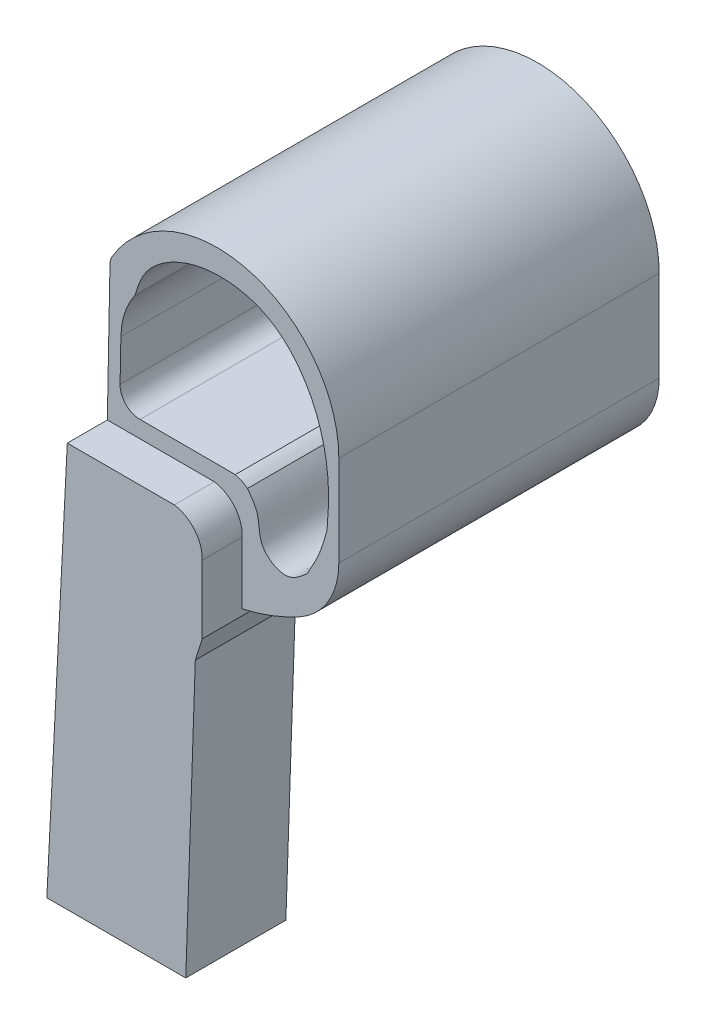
SolidWorks part; units mm, degrees
ref_plane "Ebene vorne" through (0, 0, 0) normal (0, 0, 1) x (1, 0, 0)
ref_plane "Ebene oben" through (0, 0, 0) normal (0, 1, 0) x (1, 0, 0)
ref_plane "Ebene rechts" through (0, 0, 0) normal (1, 0, 0) x (0, 0, -1)
sketch "Skizze3" plane through (0, 0, 0) normal (0, 0, 1) x (1, 0, 0)
  line L0 (-12.748, -52.9148) -> (-14.6943, -50.4877)
  line L1 (-14.6943, -50.4877) -> (-17.929, -50.4877)
  line L2 (-19.5552, -48.8102) -> (-17.5102, 17.0395)
  line L3 (-17.5102, 17.0395) -> (-16.3186, 17.0395)
  line L4 (-14.5075, 19.2478) -> (-13.9759, 46.7281)
  line L5 (-8.7711, 53.4222) -> (12.5993, 53.4222)
  line L6 (19.5494, 44.9018) -> (19.5494, 27.9209)
  line L7 (19.5494, 27.9209) -> (17.8303, 22.4647)
  line L8 (17.8303, 22.4647) -> (15.3711, -49.8358)
  line L9 (15.3711, -49.8358) -> (12.0099, -53.4594)
  line L10 (12.0099, -53.4594) -> (-12.748, -52.9148)
  circle A0 centre (0.1472, -2.0361) radius 3.5144
  arc A1 (-19.5552, -48.8102) -> (-17.929, -50.4877) centre (-17.929, -48.8607) ccw
  arc A2 (-16.3186, 17.0395) -> (-14.5075, 19.2478) centre (-16.8776, 19.3447) ccw
  arc A3 (-8.7711, 53.4222) -> (-13.9759, 46.7281) centre (-7.2405, 46.8617) ccw
  arc A4 (19.5494, 44.9018) -> (12.5993, 53.4222) centre (11.3313, 45.2932) ccw
sketch "Skizze4" plane through (0, 0, 0) normal (0, 0, 1) x (1, 0, 0)
  line L0 (-12.1967, 51.4246) -> (-13.1539, 51.4246)
  line L2 (-13.4766, 87.4439) -> (-14.1538, 52.4439)
  line L3 (19.5494, 44.9018) -> (19.5494, 27.9209) construction
  line L4 (43.6726, 51.3768) -> (43.6726, 74.0471)
  line L5 (-8.7711, 53.4222) -> (12.5993, 53.4222) construction
  line L8 (-8.7711, 53.4222) -> (12.5993, 53.4222)
  line L9 (19.5494, 44.9018) -> (19.5494, 29.4097)
  line L14 (-14.5075, 19.2478) -> (-13.9759, 46.7281) construction
  arc A0 (43.6726, 51.3768) -> (34.0095, 34.9386) centre (24.8592, 51.3768) cw
  arc A1 (43.6726, 74.0471) -> (-12.9301, 89.3862) centre (13.2929, 74.0471) ccw
  arc A2 (-12.9301, 89.3862) -> (-13.4766, 87.4439) centre (-9.4774, 87.3665) ccw
  arc A3 (-8.7711, 53.4222) -> (-13.9759, 46.7281) centre (-7.2405, 46.8617) ccw construction
  arc A4 (19.5494, 44.9018) -> (12.5993, 53.4222) centre (11.3313, 45.2932) ccw construction
  arc A5 (-8.7711, 53.4222) -> (-12.1967, 51.4246) centre (-7.2405, 46.8617) ccw
  arc A6 (19.5494, 44.9018) -> (12.5993, 53.4222) centre (11.3313, 45.2932) ccw
  arc A7 (34.0095, 34.9386) -> (19.5494, 29.4097) centre (7.5426, 82.4858) cw
  arc A8 (-14.1538, 52.4439) -> (-13.1539, 51.4246) centre (-13.1539, 52.4246) ccw
  point P13 (19.5494, 29.4097)
  point P14 (34.0095, 34.9386)
  dimension "D3" = 4
  dimension "D1" = 1
  dimension "D2" = 35
extrude "Linear austragen2" add sketch "Skizze4" against normal blind 65
sketch "Skizze8" plane through (0, 0, 0) normal (0, 0, 1) x (1, 0, 0)
  line L4 (-10.7531, 73.1244) -> (-10.9544, 62.7185)
  line L5 (-13.4766, 87.4439) -> (-14.1538, 52.4439) construction
  line L6 (-5.9641, 57.6218) -> (17.8078, 57.5801)
  arc A2 (-10.9544, 62.7185) -> (-5.9641, 57.6218) centre (-5.9554, 62.6218) ccw
  arc A3 (-10.7531, 73.1244) -> (-7.2516, 83.8309) centre (8.5054, 72.7518) cw
  arc A4 (43.6726, 74.0471) -> (-12.9301, 89.3862) centre (13.2929, 74.0471) ccw construction
  spline S0 degree 3 poles (-7.2516, 83.8309) (-6.6435, 85.7397) (-4.8338, 91.4199) (3.4739, 97.2386) (14.6974, 99.2738) (26.3685, 96.7743) (34.7702, 88.3663) (39.8457, 77.5371) (41.4737, 66.841) (40.9265, 59.6668) (40.7202, 56.961) knots 0.004715 0.004715 0.004715 0.004715 0.075335 0.214866 0.335973 0.47969 0.620641 0.743145 0.903126 1 1 1 1
  spline S1 degree 3 poles (17.8078, 57.5801) (18.2229, 57.4656) (19.3265, 57.1613) (20.2855, 56.5276) (20.8837, 56.1323) knots 0 0 0 0 0.37617 1 1 1 1
  spline S2 degree 3 poles (20.8837, 56.1323) (21.873, 54.7662) (24.1309, 51.6486) (23.2771, 45.0712) (30.5484, 40.5491) (34.0974, 43.6633) (35.7706, 45.1315) knots 0 0 0 0 0.203298 0.463965 0.74728 1 1 1 1
  spline S3 degree 3 poles (40.7202, 56.961) (40.1667, 54.9844) (39.0058, 50.8388) (36.8819, 47.0919) (35.7706, 45.1315) knots 0 0 0 0 0.476815 1 1 1 1
  point P11 (-11.5897, 91.4766)
  point P12 (-4.3987, 98.744)
  point P16 (12.0638, 104.402)
  point P17 (29.1231, 99.9765)
  point P18 (42.0464, 83.8535)
  point P19 (43.5921, 71.8367)
  point P20 (41.8776, 63.7593)
  point P21 (39.6822, 58.9961)
  point P22 (-5.0364, 89.3327)
  point P23 (4.1359, 96.6261)
  point P24 (14.1255, 98.5401)
  point P25 (25.8583, 95.7059)
  point P26 (34.4987, 87.614)
  point P27 (38.9877, 78.3563)
  point P28 (41.1046, 65.088)
  point P29 (40.7202, 56.961)
  point P35 (38.8407, 51.1216)
  point P39 (35.7706, 45.1315)
  point P41 (30.4524, 42.0953)
  point P43 (24.5857, 45.661)
  point P45 (23.3164, 51.8486)
  point P46 (20.8837, 56.1323)
  point P47 (19.0327, 57.19)
  dimension "D3" = 5
  dimension "D1" = 3
extrude "Schnitt-Linear austragen2" cut sketch "Skizze8" against normal blind 62
sketch "Skizze12" plane through (0.1012, 57.6112, 0) normal (0.0018, 1, 0) x (1, -0.0018, 0)
  line L0 (-6.0653, 62) -> (17.7066, 62) construction
  line L1 (13.0653, 62) -> (-5.2444, 62)
  line L2 (13.0653, 62) -> (13.0653, 35)
  line L3 (13.0653, 35) -> (-5.2444, 35)
  line L4 (-5.2444, 62) -> (-5.2444, 35)
  line L5 (-6.0653, 0) -> (17.7066, 0) construction
  dimension "D1" = 35
extrude "Schnitt-Linear austragen3" cut sketch "Skizze12" against normal up to next
sketch "Skizze14" plane through (0, 0, 0) normal (0, 0, 1) x (1, 0, 0)
  line L0 (43.6726, 51.3768) -> (43.6726, 74.0471) construction
  line L1 (-13.4766, 87.4439) -> (-14.1538, 52.4439) construction
  line L2 (-13.1539, 51.4246) -> (-12.1967, 51.4246) construction
  line L3 (43.6726, 51.3768) -> (43.6726, 74.0471)
  line L4 (-13.4766, 87.4439) -> (-14.1538, 52.4439)
  line L5 (-13.1539, 51.4246) -> (-12.1967, 51.4246)
  line L6 (19.5494, 44.9018) -> (19.5494, 27.9209) construction
  line L7 (-8.7711, 53.4222) -> (12.5993, 53.4222) construction
  line L8 (19.5494, 44.9018) -> (19.5494, 29.4097)
  line L9 (-8.7711, 53.4222) -> (12.5993, 53.4222)
  line L10 (-5.9641, 57.6218) -> (17.8078, 57.5801) construction
  line L11 (-10.7531, 73.1244) -> (-10.9544, 62.7185) construction
  line L12 (-5.9641, 57.6218) -> (17.8078, 57.5801)
  line L13 (-10.7531, 73.1244) -> (-10.9544, 62.7185)
  arc A0 (19.5494, 29.4097) -> (34.0095, 34.9386) centre (7.5426, 82.4858) ccw construction
  arc A1 (34.0095, 34.9386) -> (43.6726, 51.3768) centre (24.8592, 51.3768) ccw construction
  arc A2 (43.6726, 74.0471) -> (-12.9301, 89.3862) centre (13.2929, 74.0471) ccw construction
  arc A3 (-12.9301, 89.3862) -> (-13.4766, 87.4439) centre (-9.4774, 87.3665) ccw construction
  arc A4 (-14.1538, 52.4439) -> (-13.1539, 51.4246) centre (-13.1539, 52.4246) ccw construction
  arc A5 (19.5494, 29.4097) -> (34.0095, 34.9386) centre (7.5426, 82.4858) ccw
  arc A6 (34.0095, 34.9386) -> (43.6726, 51.3768) centre (24.8592, 51.3768) ccw
  arc A7 (43.6726, 74.0471) -> (-12.9301, 89.3862) centre (13.2929, 74.0471) ccw
  arc A8 (-12.9301, 89.3862) -> (-13.4766, 87.4439) centre (-9.4774, 87.3665) ccw
  arc A9 (-14.1538, 52.4439) -> (-13.1539, 51.4246) centre (-13.1539, 52.4246) ccw
  arc A10 (19.5494, 44.9018) -> (12.5993, 53.4222) centre (11.3313, 45.2932) ccw construction
  arc A11 (-8.7711, 53.4222) -> (-13.9759, 46.7281) centre (-7.2405, 46.8617) ccw construction
  arc A12 (19.5494, 44.9018) -> (12.5993, 53.4222) centre (11.3313, 45.2932) ccw
  arc A13 (-8.7711, 53.4222) -> (-12.1967, 51.4246) centre (-7.2405, 46.8617) ccw
  arc A14 (-7.2516, 83.8309) -> (-10.7531, 73.1244) centre (8.5054, 72.7518) ccw construction
  arc A15 (-10.9544, 62.7185) -> (-5.9641, 57.6218) centre (-5.9554, 62.6218) ccw construction
  arc A16 (-7.2516, 83.8309) -> (-10.7531, 73.1244) centre (8.5054, 72.7518) ccw
  arc A17 (-10.9544, 62.7185) -> (-5.9641, 57.6218) centre (-5.9554, 62.6218) ccw
  spline S0 degree 3 poles (1025.7421, -115.4157) (-27.2261, -25.3968) (48.2028, 22.6285) (39.8457, 77.5371) (34.7702, 88.3663) (26.3685, 96.7743) (14.6974, 99.2738) (3.4739, 97.2386) (-28.0379, 75.1679) (44.505, -2.829) (-910.0481, 513.8951) knots -1.563367 -1.563367 -1.563367 -1.563367 0.101589 0.261571 0.384074 0.525026 0.668743 0.78985 0.929381 1.925227 1.925227 1.925227 1.925227 only from (40.7202, 56.961) to (-7.2516, 83.8309) construction
  spline S1 degree 3 poles (915.8138, -429.7609) (-58.0867, 12.6954) (105.4163, 22.2179) (0.6552, 142.7976) (998.0128, -232.1593) knots -7.966825 -7.966825 -7.966825 -7.966825 0.523185 8.723009 8.723009 8.723009 8.723009 only from (35.7706, 45.1315) to (40.7202, 56.961) construction
  spline S2 degree 3 poles (944.8575, 438.5834) (-81.1842, 60.5817) (26.953, 73.3892) (23.2771, 45.0712) (51.3521, 27.6109) (39.9912, 181.48) (300.1258, -919.2923) knots -2.470029 -2.470029 -2.470029 -2.470029 0.203298 0.463965 0.74728 3.279414 3.279414 3.279414 3.279414 only from (20.8837, 56.1323) to (35.7706, 45.1315) construction
  spline S3 degree 3 poles (387.9335, 986.5601) (-19.1556, 29.6191) (40.5609, 100.2465) (22.4179, -6.4684) (460.009, 954.5574) knots -10.165412 -10.165412 -10.165412 -10.165412 0.37617 13.039429 13.039429 13.039429 13.039429 only from (17.8078, 57.5801) to (20.8837, 56.1323) construction
  spline S4 degree 3 poles (40.7202, 56.961) (40.9265, 59.6668) (41.4737, 66.841) (39.8457, 77.5371) (34.7702, 88.3663) (26.3685, 96.7743) (14.6974, 99.2738) (3.4739, 97.2386) (-4.8338, 91.4199) (-6.6435, 85.7397) (-7.2516, 83.8309) knots 0.004715 0.004715 0.004715 0.004715 0.101589 0.261571 0.384074 0.525026 0.668743 0.78985 0.929381 1 1 1 1
  spline S5 degree 3 poles (35.7706, 45.1315) (36.8819, 47.0919) (39.0058, 50.8388) (40.1667, 54.9844) (40.7202, 56.961) knots 0 0 0 0 0.523185 1 1 1 1
  spline S6 degree 3 poles (20.8837, 56.1323) (21.873, 54.7662) (24.1309, 51.6486) (23.2771, 45.0712) (30.5484, 40.5491) (34.0974, 43.6633) (35.7706, 45.1315) knots 0 0 0 0 0.203298 0.463965 0.74728 1 1 1 1
  spline S7 degree 3 poles (17.8078, 57.5801) (18.2229, 57.4656) (19.3265, 57.1613) (20.2855, 56.5276) (20.8837, 56.1323) knots 0 0 0 0 0.37617 1 1 1 1
sketch "Skizze13" plane through (0, 0, 0) normal (0, 0, 1) x (1, 0, 0)
  line L0 (-13.4766, 87.4439) -> (-14.1538, 52.4439) construction
  line L1 (-19.2498, -47.464) -> (15.4518, -47.464)
  line L2 (17.8303, 22.4647) -> (15.3711, -49.8358) construction
  line L3 (15.4518, -47.464) -> (17.8303, 22.4647)
  line L4 (19.5494, 44.9018) -> (19.5494, 27.9209) construction
  line L5 (19.5494, 27.9209) -> (17.8303, 22.4647) construction
  line L6 (19.5494, 44.9018) -> (19.5494, 27.9209)
  line L7 (19.5494, 27.9209) -> (17.8303, 22.4647)
  line L9 (-14.1348, 53.4222) -> (-19.2498, -47.464)
  line L10 (-8.7711, 53.4222) -> (12.5993, 53.4222) construction
  line L11 (-14.1348, 53.4222) -> (12.5993, 53.4222)
  arc A0 (19.5494, 44.9018) -> (12.5993, 53.4222) centre (11.3313, 45.2932) ccw construction
  arc A1 (19.5494, 44.9018) -> (12.5993, 53.4222) centre (11.3313, 45.2932) ccw
extrude "Linear austragen7" add sketch "Skizze13" along normal blind 25 separate body
extrude "Linear austragen8" add sketch "Skizze14" along normal blind 15
sketch "Skizze15" plane through (0, 0, 15) normal (0, 0, 1) x (1, 0, 0)
  line L0 (19.5494, 44.9018) -> (19.5494, 29.4097) construction
  line L1 (-14.1348, 53.4222) -> (12.5993, 53.4222) construction
  line L2 (-13.4766, 87.4439) -> (-14.1348, 53.4222) construction
  line L3 (43.6726, 51.3768) -> (43.6726, 74.0471) construction
  line L4 (19.5494, 44.9018) -> (19.5494, 29.4097)
  line L5 (-14.1348, 53.4222) -> (12.5993, 53.4222)
  line L6 (-13.4766, 87.4439) -> (-14.1348, 53.4222)
  line L7 (43.6726, 51.3768) -> (43.6726, 74.0471)
  arc A0 (19.5494, 44.9018) -> (12.5993, 53.4222) centre (11.3313, 45.2932) ccw construction
  arc A1 (-12.9301, 89.3862) -> (-13.4766, 87.4439) centre (-9.4774, 87.3665) ccw construction
  arc A2 (43.6726, 74.0471) -> (-12.9301, 89.3862) centre (13.2929, 74.0471) ccw construction
  arc A3 (34.0095, 34.9386) -> (43.6726, 51.3768) centre (24.8592, 51.3768) ccw construction
  arc A4 (19.5494, 29.4097) -> (34.0095, 34.9386) centre (7.5426, 82.4858) ccw construction
  arc A5 (19.5494, 44.9018) -> (12.5993, 53.4222) centre (11.3313, 45.2932) ccw
  arc A6 (-12.9301, 89.3862) -> (-13.4766, 87.4439) centre (-9.4774, 87.3665) ccw
  arc A7 (43.6726, 74.0471) -> (-12.9301, 89.3862) centre (13.2929, 74.0471) ccw
  arc A8 (34.0095, 34.9386) -> (43.6726, 51.3768) centre (24.8592, 51.3768) ccw
  arc A9 (19.5494, 29.4097) -> (34.0095, 34.9386) centre (7.5426, 82.4858) ccw
sketch "Skizze16" plane through (0, 0, 25) normal (0, 0, 1) x (1, 0, 0)
  line L0 (12.5993, 53.4222) -> (-14.1348, 53.4222) construction
  line L2 (12.5993, 53.4222) -> (-14.1348, 53.4222)
  line L3 (-14.1348, 53.4222) -> (-13.5715, 82.5406)
  line L5 (-8.5724, 87.4439) -> (14.5494, 87.4439)
  line L6 (19.5494, 82.4439) -> (19.5494, 45.6845)
  arc A0 (19.5494, 44.9018) -> (12.5993, 53.4222) centre (11.3313, 45.2932) ccw construction
  arc A1 (19.5494, 45.6845) -> (12.5993, 53.4222) centre (11.3313, 45.2932) ccw
  arc A2 (-8.5724, 87.4439) -> (-13.5715, 82.5406) centre (-8.5724, 82.4439) ccw
  arc A3 (19.5494, 82.4439) -> (14.5494, 87.4439) centre (14.5494, 82.4439) ccw
  point P6 (-13.4766, 87.4439)
  dimension "D1" = 5
sketch3d "3D-Skizze3"
  line L0 (19.5494, 66.4477, 25) -> (43.6726, 69.7695, 15)
  line L1 (19.5494, 82.4439, 25) -> (19.5494, 45.6845, 25) construction
  line L2 (43.6726, 51.3768, 15) -> (43.6726, 74.0471, 15) construction
  line L3 (19.5494, 79.1783, 25) -> (39.7856, 88.9152, 15)
  line L4 (10.1704, 87.4439, 25) -> (25.2939, 101.956, 15)
  line L5 (-8.5724, 87.4439, 25) -> (14.5494, 87.4439, 25) construction
  line L6 (2.9885, 87.4439, 25) -> (11.656, 104.3827, 15)
  line L7 (19.5494, 55.0435, 25) -> (43.6726, 58.6608, 15)
  line L8 (19.5494, 48.3098, 25) -> (39.2618, 39.2727, 15)
  line L9 (19.5494, 45.6845, 25) -> (19.5494, 29.4097, 15)
  arc A0 (43.6726, 74.0471, 15) -> (-12.9301, 89.3862, 15) centre (13.2929, 74.0471, 15) ccw construction
  arc A1 (34.0095, 34.9386, 15) -> (43.6726, 51.3768, 15) centre (24.8592, 51.3768, 15) ccw construction
  point P11 (13.2929, 74.0471, 45.3797)
  point P25 (24.8592, 51.3768, 33.8133)
